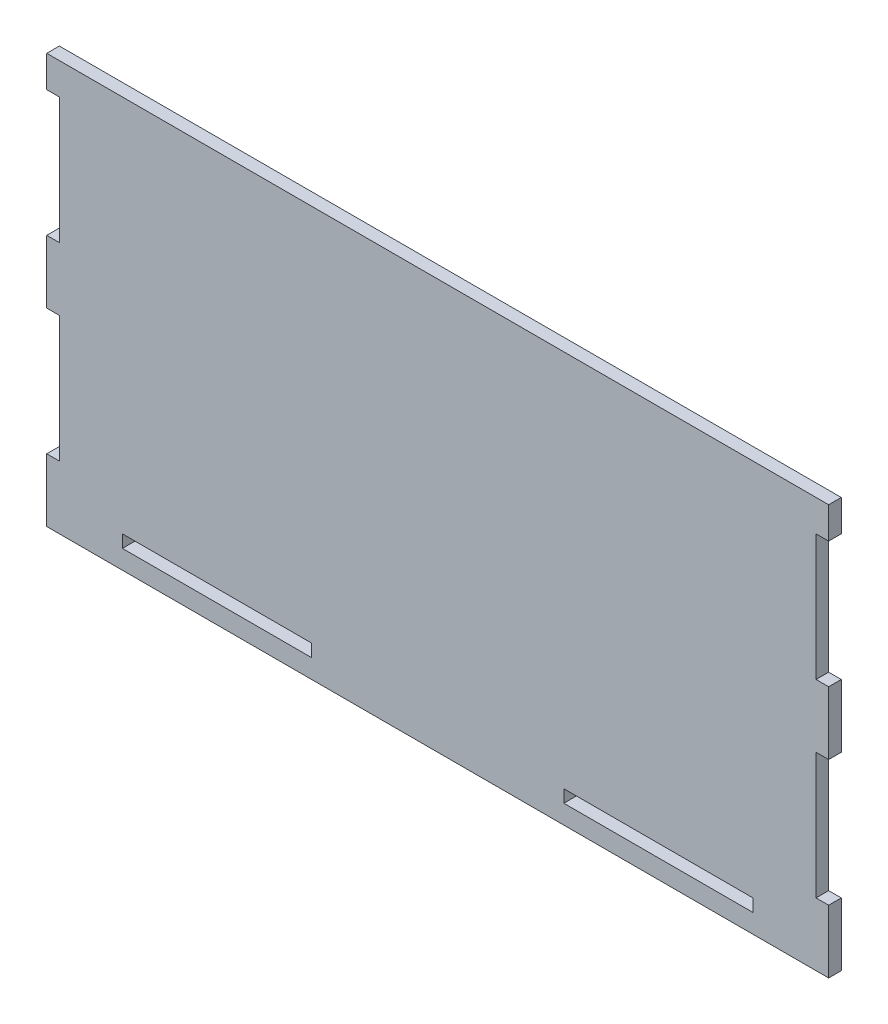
SolidWorks part; units mm, degrees
ref_plane "Alzado" through (0, 0, 0) normal (0, 0, 1) x (1, 0, 0)
ref_plane "Planta" through (0, 0, 0) normal (0, 1, 0) x (1, 0, 0)
ref_plane "Vista lateral" through (0, 0, 0) normal (1, 0, 0) x (0, 0, -1)
sketch "Croquis1" plane through (0, 0, 0) normal (0, 0, 1) x (1, 0, 0)
  line L0 (620, 0) -> (620, 184.7119) construction
  line L1 (0, 0) -> (1240, 0)
  line L2 (0, 0) -> (0, 100)
  line L3 (0, 650) -> (1240, 650)
  line L4 (1240, 0) -> (1240, 100)
  line L5 (1240, 100) -> (1220, 100)
  line L6 (0, 600) -> (20, 600)
  line L8 (0, 400) -> (20, 400)
  line L9 (20, 600) -> (20, 400)
  line L10 (0, 300) -> (20, 300)
  line L12 (0, 100) -> (20, 100)
  line L13 (20, 300) -> (20, 100)
  line L14 (120, 30) -> (420, 30)
  line L15 (120, 30) -> (120, 50)
  line L16 (120, 50) -> (420, 50)
  line L17 (420, 30) -> (420, 50)
  line L18 (820, 50) -> (1120, 50)
  line L19 (820, 50) -> (820, 30)
  line L20 (820, 30) -> (1120, 30)
  line L21 (1120, 50) -> (1120, 30)
  line L22 (1220, 300) -> (1220, 100)
  line L23 (1240, 300) -> (1220, 300)
  line L25 (1240, 400) -> (1220, 400)
  line L26 (1220, 600) -> (1220, 400)
  line L27 (1240, 600) -> (1220, 600)
  line L29 (0, 600) -> (0, 650)
  line L30 (0, 300) -> (0, 400)
  line L31 (1240, 600) -> (1240, 650)
  line L32 (1240, 300) -> (1240, 400)
  dimension "D1" = 1240
  dimension "D2" = 650
  dimension "D3" = 20
  dimension "D4" = 300
  dimension "D5" = 200
  dimension "D6" = 50
  dimension "D7" = 120
  dimension "D8" = 50
  dimension "D9" = 50
  dimension "D10" = 120
extrude "Saliente-Extruir1" add sketch "Croquis1" along normal blind 20
